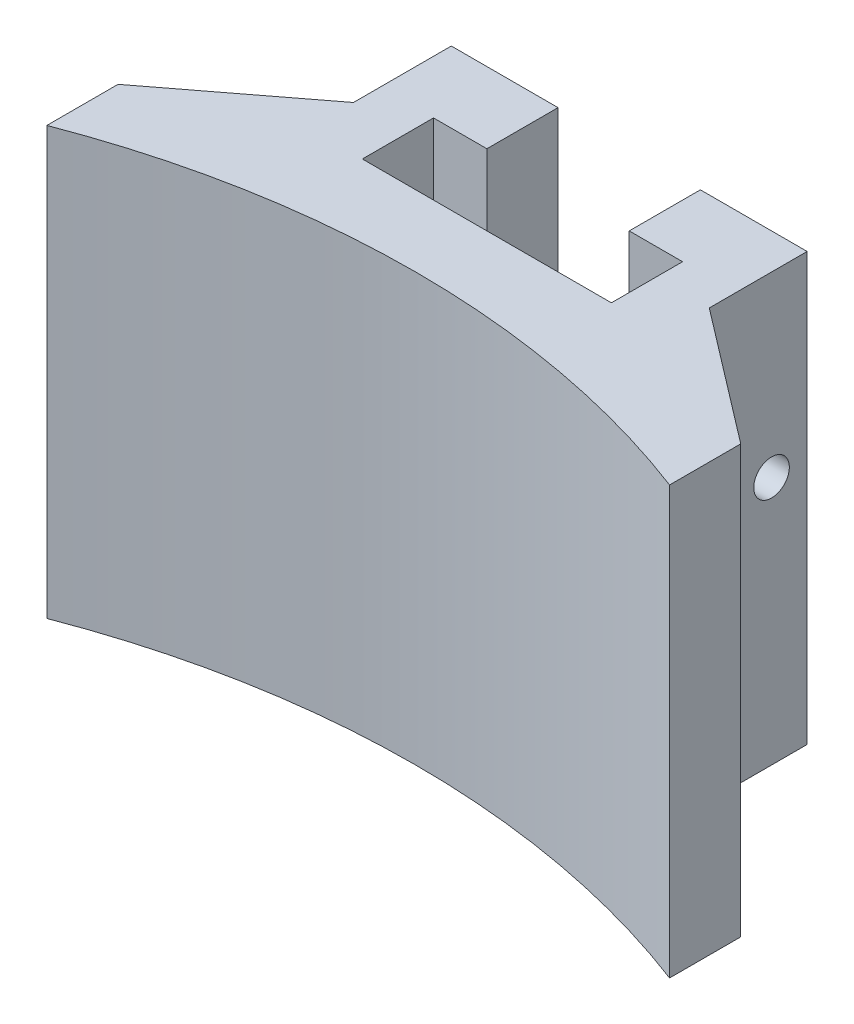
SolidWorks part; units mm, degrees
ref_plane "Front Plane" through (0, 0, 0) normal (0, 0, 1) x (1, 0, 0)
ref_plane "Top Plane" through (0, 0, 0) normal (0, 1, 0) x (1, 0, 0)
ref_plane "Right Plane" through (0, 0, 0) normal (1, 0, 0) x (0, 0, -1)
sketch "Sketch1" plane through (0, 0, 0) normal (0, 0, 1) x (1, 0, 0)
  line L1 (-10, -12) -> (10, -12)
  line L2 (-10, -12) -> (-10, 12)
  line L3 (-10, 12) -> (10, 12)
  line L4 (10, -12) -> (10, 12)
  line L5 (-10, -12) -> (10, 12) construction
  line L6 (-10, 12) -> (10, -12) construction
  point P0 (0, 0)
  dimension "D1" = 24
  dimension "D2" = 20
extrude "Boss-Extrude1" add sketch "Sketch1" along normal blind 11 contours L3 L4 L1 L2
sketch "Sketch2" plane through (0, 12, 0) normal (0, 1, 0) x (1, 0, 0)
  line L0 (-4, 0) -> (4, 0)
  line L1 (-10, 0) -> (10, 0) construction
  line L2 (4, 0) -> (4, -4)
  line L4 (-4, -4) -> (-4, 0)
  line L5 (-4, -4) -> (-7, -4)
  line L6 (-7, -4) -> (-7, -8)
  line L7 (-7, -8) -> (7, -8)
  line L8 (7, -8) -> (7, -4)
  line L9 (7, -4) -> (4, -4)
  point P0 (0, -8)
  point P6 (0, 0)
  dimension "D1" = 8
  dimension "D2" = 4
  dimension "D3" = 4
  dimension "D4" = 14
extrude "Cut-Extrude1" cut sketch "Sketch2" against normal blind 20
sketch "Sketch3" plane through (-10, 0, 0) normal (-1, 0, 0) x (0, 0, 1)
  line L0 (11, 12) -> (0, 12) construction
  line L1 (0, -12) -> (0, 12) construction
  circle A0 centre (2, 2) radius 1
  dimension "D3" = 2
  dimension "D1" = 10
  dimension "D2" = 2
extrude "Cut-Extrude2" cut sketch "Sketch3" against normal through all
sketch "Sketch4" plane through (0, -12, 0) normal (0, -1, 0) x (1, 0, 0)
  line L0 (0, 0) -> (0, 20.7207) construction
  line L1 (17.5, 15.2316) -> (17.5, 11.2316)
  line L2 (17.5, 11.2316) -> (10, 5.5)
  line L3 (10, 11) -> (10, 0) construction
  line L4 (10, 5.5) -> (10, 11)
  line L7 (-10, 5.5) -> (-10, 11)
  line L8 (-17.5, 11.2316) -> (-10, 5.5)
  line L9 (-17.5, 15.2316) -> (-17.5, 11.2316)
  line L10 (-10, 11) -> (-10, 0) construction
  line L12 (-10, 11) -> (10, 11)
  arc A0 (-17.5, 15.2316) -> (17.5, 15.2316) centre (0, 61) ccw
  point P1 (0, 12)
  point P18 (0, 11)
  dimension "D1" = 49
  dimension "D2" = 7.5
  dimension "D3" = 4
  dimension "D4" = 1
  dimension "D5" = 11
  dimension "D6" = 10
extrude "Boss-Extrude2" add sketch "Sketch4" against normal up to surface (24 mm away)
